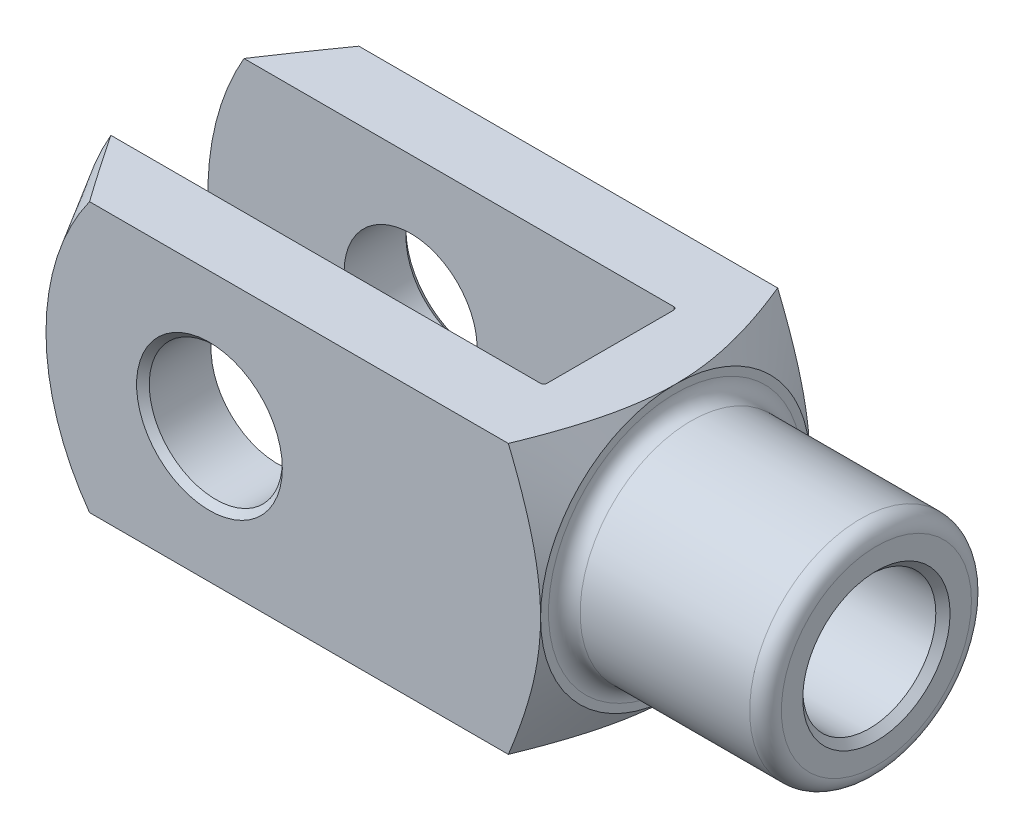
SolidWorks part; units mm, degrees
ref_plane "Front Plane" through (0, 0, 0) normal (0, 0, 1) x (1, 0, 0)
ref_plane "Top Plane" through (0, 0, 0) normal (0, 1, 0) x (1, 0, 0)
ref_plane "Right Plane" through (0, 0, 0) normal (1, 0, 0) x (0, 0, -1)
sketch "Sketch1" plane through (0, 0, 0) normal (1, 0, 0) x (0, 0, -1)
  line L0 (0, 0) -> (0, 50000) construction
  line L1 (0, 0) -> (50000, 0) construction
  line L2 (-42.5, -42.5) -> (-42.5, 42.5)
  line L3 (-42.5, 42.5) -> (42.5, 42.5)
  line L4 (42.5, -42.5) -> (42.5, 42.5)
  line L5 (-42.5, -42.5) -> (42.5, -42.5)
  point P9 (0, 42.5)
  point P11 (42.5, 0)
  point P12 (-42.5, 0)
  dimension "D1" = 85
  dimension "D2" = 85
extrude "Extrude1" add sketch "Sketch1" against normal blind 232
sketch "Sketch2" plane through (0, 0, 0) normal (1, 0, 0) x (0, 0, -1)
  circle A0 centre (0, 0) radius 35
  circle A1 centre (0, 0) radius 70
  dimension "D1" = 70
  dimension "D2" = 140
extrude "Extrude2" cut sketch "Sketch2" against normal blind 63.5
sketch "Sketch3" plane through (0, 0, 42.5) normal (0, 0, 1) x (1, 0, 0)
  circle A0 centre (-168, 0) radius 21
  dimension "D1" = 42
  dimension "D2" = 168
extrude "Extrude3" cut sketch "Sketch3" against normal through all
sketch "Sketch4" plane through (0, 42.5, 0) normal (0, 1, 0) x (1, 0, 0)
  line L0 (0, 0) -> (-50000, 0) construction
  line L1 (-232, -21) -> (-232, 21)
  line L2 (-232, 42.5) -> (-232, -42.5) construction
  line L3 (-232, 21) -> (-84, 21)
  line L4 (-84, 21) -> (-84, -21)
  line L5 (-168, 42.5) -> (-168, -42.5) construction
  line L6 (-232, -21) -> (-84, -21)
  point P7 (-168, 0)
  point P13 (-84, 0)
  point P14 (-232, 0)
  dimension "D1" = 84
  dimension "D2" = 42
extrude "Extrude4" cut sketch "Sketch4" against normal through all
fillet "Fillet1" radius 1 2 edges at (-84, 0, 21) (-84, 0, -21)
fillet "Fillet2" radius 5 2 edges at (0, 0, -35) (-63.5, 0, -35)
chamfer "Chamfer2" distance 2 angle 45 2 edges at (-147, 0, -42.5) (-147, 0, 42.5)
sketch "Sketch6" plane through (0, 0, 0) normal (0, 0, 1) x (1, 0, 0)
  line L0 (-63.5, -42.5) -> (-63.5, -85)
  line L1 (-63.5, -85) -> (-88.0374, -85)
  line L2 (-88.0374, -85) -> (-63.5, -42.5)
  dimension "D1" = 30
  dimension "D2" = 85
revolve "Cut-Revolve1" cut sketch "Sketch6" angle 360 about axis through (-63.5, 0, 0) along (1, 0, 0)
sketch "Sketch7" plane through (0, 0, 0) normal (0, 1, 0) x (1, 0, 0)
  line L0 (-219.587, -42.5) -> (-232, -21)
  line L1 (-232, 21) -> (-219.587, 42.5)
  line L2 (-219.587, 42.5) -> (-317, 42.5)
  line L3 (-232, 21) -> (-232, -21)
  line L4 (-317, 42.5) -> (-317, -42.5)
  line L5 (-317, -42.5) -> (-219.587, -42.5)
  line L6 (-232, 42.5) -> (-73.6637, 42.5) construction
  line L7 (-232, -42.5) -> (-73.6637, -42.5) construction
  line L8 (-147, 0.6162) -> (-147, 50000.6162) construction
  dimension "D1" = 120
  dimension "D2" = 85
  dimension "D3" = 85
revolve "Cut-Revolve2" cut sketch "Sketch7" angle 180 about L8
sketch "Sketch8" plane through (0, 0, 0) normal (1, 0, 0) x (0, 0, -1)
  circle A0 centre (0, 0) radius 21
  dimension "D1" = 42
extrude "Extrude5" cut sketch "Sketch8" against normal through all
chamfer "Chamfer3" distance 2.25 angle 45 1 edges at (0, 0, -21)
equation "\"D2@Sketch1\" = \"D1@Sketch1\""
equation "\"D2@Sketch2\" = \"D1@Sketch2\"*2"
equation "\"D2@Sketch6\" = \"D1@Sketch1\""
equation "\"D2@Sketch7\" = \"D1@Sketch1\""
equation "\"D3@Sketch7\" = \"D1@Sketch1\""
